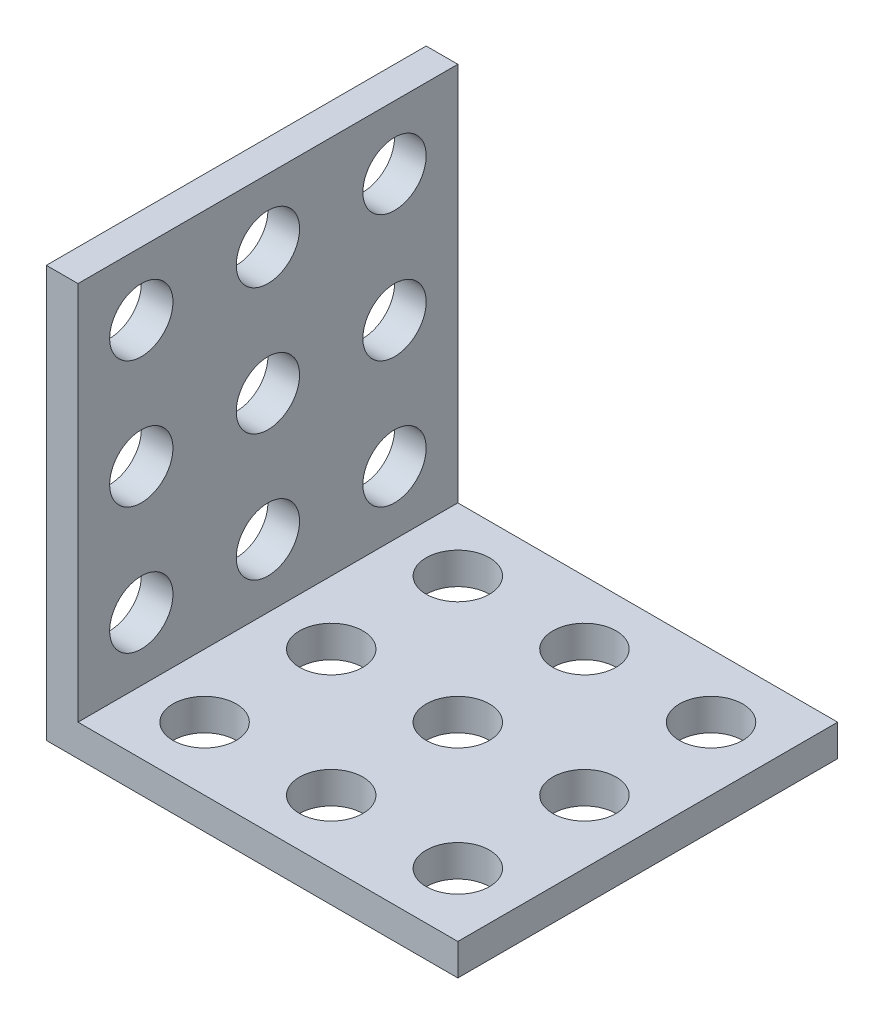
SolidWorks part; units mm, degrees
ref_plane "前视基准面" through (0, 0, 0) normal (0, 0, 1) x (1, 0, 0)
ref_plane "上视基准面" through (0, 0, 0) normal (0, 1, 0) x (1, 0, 0)
ref_plane "右视基准面" through (0, 0, 0) normal (1, 0, 0) x (0, 0, -1)
sketch "草图1" plane through (0, 0, 0) normal (0, 0, 1) x (1, 0, 0)
  line L0 (0, 0) -> (0, 26)
  line L1 (0, 26) -> (2, 26)
  line L2 (2, 26) -> (2, 2)
  line L3 (2, 2) -> (26, 2)
  line L4 (26, 2) -> (26, 0)
  line L5 (26, 0) -> (0, 0)
  dimension "D1" = 2
  dimension "D2" = 26
extrude "凸台-拉伸1" add sketch "草图1" along normal blind 24
sketch "草图2" plane through (0, 2, 0) normal (0, 1, 0) x (1, 0, 0)
  line L0 (0, -24) -> (0, 0) construction
  line L1 (26, -24) -> (2, -24) construction
  circle A0 centre (6, -20) radius 2
  circle A1 centre (14, -20) radius 2
  circle A2 centre (22, -20) radius 2
  circle A3 centre (14, -12) radius 2
  circle A4 centre (22, -12) radius 2
  circle A5 centre (14, -4) radius 2
  circle A6 centre (22, -4) radius 2
  circle A7 centre (6, -12) radius 2
  circle A8 centre (6, -4) radius 2
  dimension "D1" = 6
  dimension "D3" = 4
  dimension "D2" = 4
  dimension "D4" = 3
  dimension "D5" = 3
extrude "切除-拉伸1" cut sketch "草图2" against normal blind 24
sketch "草图3" plane through (2, 0, 0) normal (1, 0, 0) x (0, 0, -1)
  line L0 (-24, 0) -> (0, 0) construction
  line L1 (-24, 2) -> (-24, 26) construction
  circle A0 centre (-20, 6) radius 2
  circle A1 centre (-12, 6) radius 2
  circle A2 centre (-4, 6) radius 2
  circle A3 centre (-12, 14) radius 2
  circle A4 centre (-4, 14) radius 2
  circle A5 centre (-12, 22) radius 2
  circle A6 centre (-4, 22) radius 2
  circle A7 centre (-20, 14) radius 2
  circle A8 centre (-20, 22) radius 2
  dimension "D1" = 4
  dimension "D3" = 4
  dimension "D2" = 6
  dimension "D4" = 3
  dimension "D5" = 3
extrude "切除-拉伸2" cut sketch "草图3" against normal blind 24
